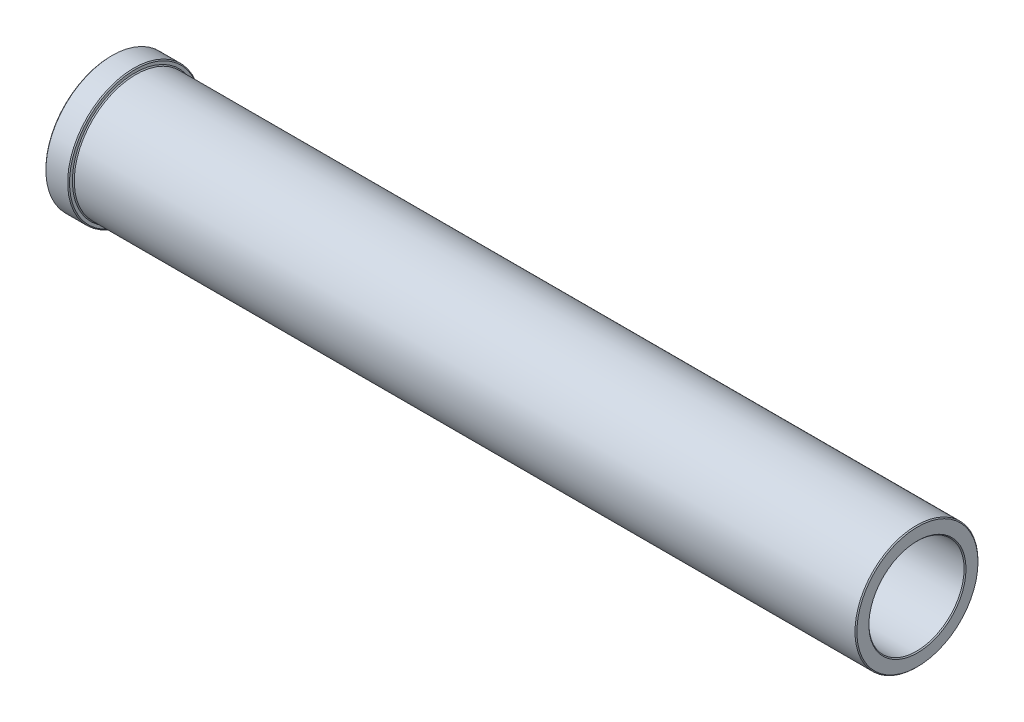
SolidWorks part; units mm, degrees
ref_plane "Plan de face" through (0, 0, 0) normal (0, 0, 1) x (1, 0, 0)
ref_plane "Plan de dessus" through (0, 0, 0) normal (0, 1, 0) x (1, 0, 0)
ref_plane "Plan de droite" through (0, 0, 0) normal (1, 0, 0) x (0, 0, -1)
sketch "Esquisse1" plane through (0, 0, 0) normal (0, 0, 1) x (1, 0, 0)
  line L0 (38.3645, 0) -> (-255.5869, 0) construction
  line L1 (0, 51.3) -> (0, 64)
  line L2 (-1, 65) -> (-826, 65)
  line L3 (-1, 50.3) -> (-121, 50.3)
  line L4 (-122, 51.3) -> (-122, 53)
  line L5 (-123, 54) -> (-851, 54)
  line L6 (-852, 55) -> (-852, 69)
  line L7 (-851, 70) -> (-828, 70)
  line L8 (-851, 54) -> (-852, 55)
  line L9 (-122, 53) -> (-123, 54)
  line L10 (-121, 50.3) -> (-122, 51.3)
  line L11 (0, 64) -> (-1, 65)
  line L12 (-1, 50.3) -> (0, 51.3)
  line L13 (-827, 69) -> (-827, 66)
  line L14 (-852, 69) -> (-851, 70)
  line L15 (-828, 70) -> (-827, 69)
  line L16 (-827, 66) -> (-826, 65)
  point P3 (0, 50.3)
  point P4 (0, 65)
  point P5 (-827, 65)
  point P7 (-122, 50.3)
  point P8 (-122, 54)
  point P9 (-852, 54)
  point P10 (-852, 70)
  point P22 (-827, 70)
  dimension "D1" = 65
  dimension "D2" = 50.3
  dimension "D3" = 122
  dimension "D4" = 70
  dimension "D5" = 54
  dimension "D6" = 25
  dimension "D9" = 1
  dimension "D10" = 1
  dimension "D11" = 1
  dimension "D12" = 1
  dimension "D13" = 1
  dimension "D7" = 852
  dimension "D15" = 1
  dimension "D16" = 1
  dimension "D17" = 1
revolve "Révolution1" add sketch "Esquisse1" angle 360 about L0
sketch "Esquisse2" plane through (-852, 0, 0) normal (-1, 0, 0) x (0, 0, 1)
  point P0 (0, 0)
sketch "Esquisse3" plane through (-122, 0, 0) normal (-1, 0, 0) x (0, 0, 1)
  point P0 (0, 0)
  dimension "D3" = 1
  dimension "D8" = 1
